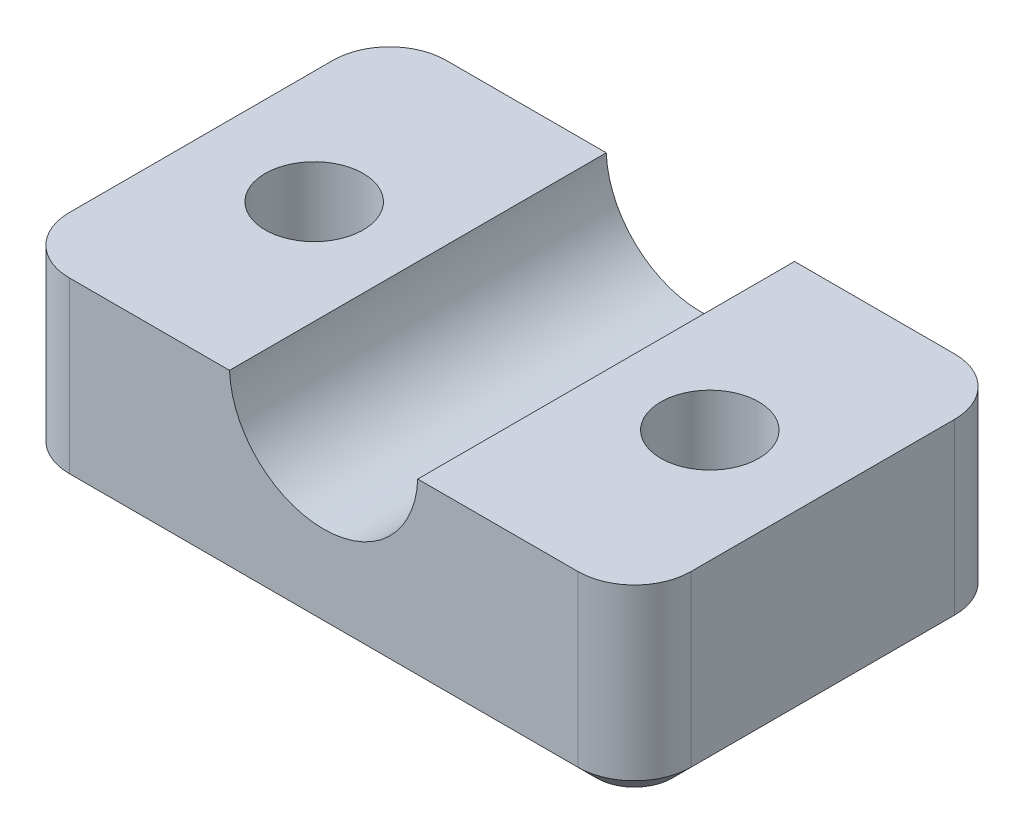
SolidWorks part; units mm, degrees
ref_plane "Front Plane" through (0, 0, 0) normal (0, 0, 1) x (1, 0, 0)
ref_plane "Top Plane" through (0, 0, 0) normal (0, 1, 0) x (1, 0, 0)
ref_plane "Right Plane" through (0, 0, 0) normal (1, 0, 0) x (0, 0, -1)
sketch "Sketch1" plane through (0, 0, 0) normal (0, 1, 0) x (1, 0, 0)
  line L0 (-50.7915, 0) -> (50.7915, 0) construction
  line L1 (0, -10) -> (0, 10) construction
  line L2 (-13.5, -10) -> (13.5, -10)
  line L3 (-16.5, -7) -> (-16.5, 7)
  line L4 (-13.5, 10) -> (13.5, 10)
  line L5 (16.5, -7) -> (16.5, 7)
  line L6 (-16.5, -10) -> (16.5, 10) construction
  line L7 (-16.5, 10) -> (16.5, -10) construction
  arc A0 (-16.5, -7) -> (-13.5, -10) centre (-13.5, -7) ccw
  arc A1 (13.5, -10) -> (16.5, -7) centre (13.5, -7) ccw
  arc A2 (16.5, 7) -> (13.5, 10) centre (13.5, 7) ccw
  arc A3 (-13.5, 10) -> (-16.5, 7) centre (-13.5, 7) ccw
  circle A4 centre (10.5, 0) radius 2.6
  circle A5 centre (-10.5, 0) radius 2.6
  point P3 (0, 0)
  dimension "D3" = 3
  dimension "D4" = 5.2
  dimension "D5" = 10.5
  dimension "D1" = 33
  dimension "D2" = 20
extrude "Boss-Extrude3" add sketch "Sketch1" along normal blind 10
sketch "Sketch5" plane through (0, 0, -10) normal (0, 0, -1) x (-1, 0, 0)
  line L0 (0, 0) -> (0, 17.6887) construction
  line L1 (-13.5, 0) -> (13.5, 0) construction
  circle A0 centre (0, 10.2) radius 5
  dimension "D1" = 10.2
  dimension "D2" = 10
extrude "Cut-Extrude3" cut sketch "Sketch5" against normal up to surface (20 mm away)
chamfer "Chamfer1" distance 1 angle 45 8 edges at (-15.6213, 0, -9.1213) (-16.5, 0, 0) (0, 0, -10) (-15.6213, 0, 9.1213) (15.6213, 0, -9.1213) (0, 0, 10) (16.5, 0, 0) (15.6213, 0, 9.1213)
